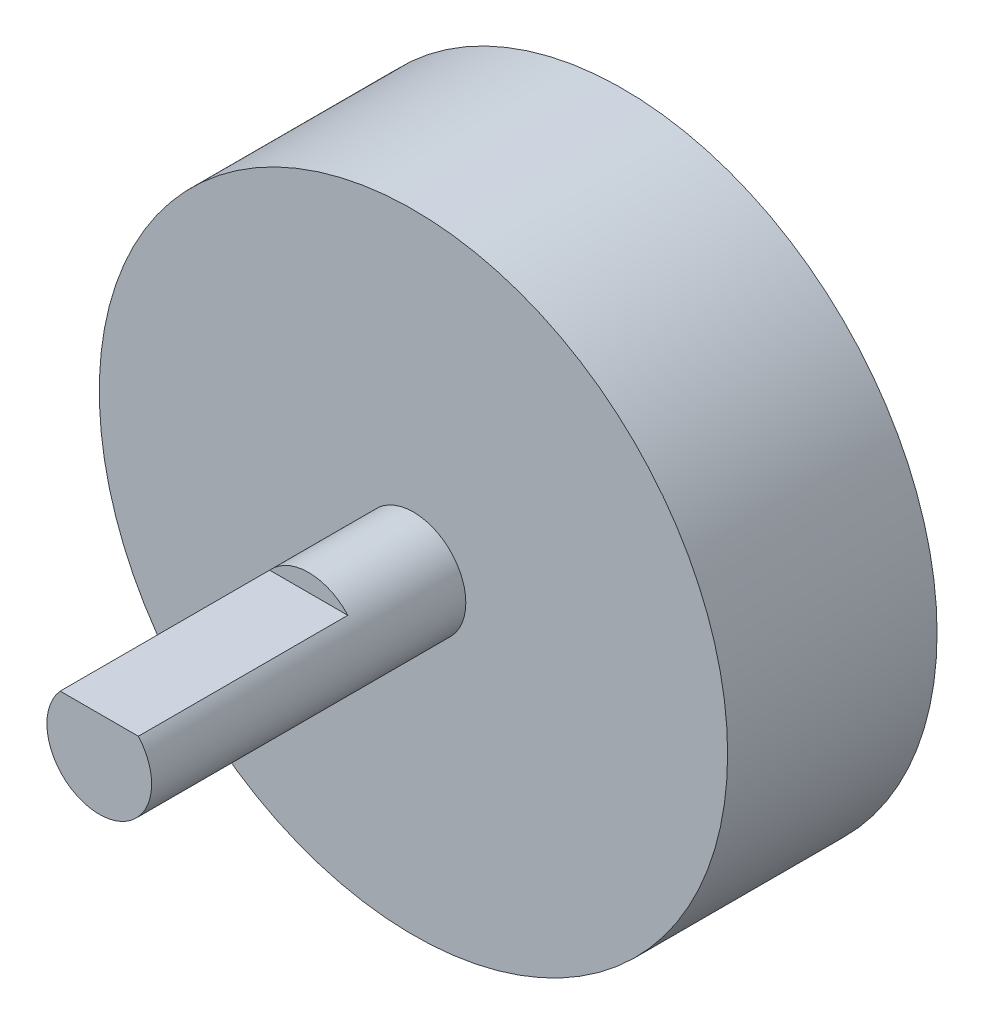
SolidWorks part; units mm, degrees
ref_plane "Front Plane" through (0, 0, 0) normal (0, 0, 1) x (1, 0, 0)
ref_plane "Top Plane" through (0, 0, 0) normal (0, 1, 0) x (1, 0, 0)
ref_plane "Right Plane" through (0, 0, 0) normal (1, 0, 0) x (0, 0, -1)
sketch "Sketch1" plane through (0, 0, 0) normal (0, 0, 1) x (1, 0, 0)
  circle A0 centre (0, 0) radius 19.05
extrude "Boss-Extrude1" add sketch "Sketch1" along normal blind 12.7
sketch "Sketch2" plane through (0, 0, 12.7) normal (0, 0, 1) x (1, 0, 0)
  circle A0 centre (0, 0) radius 3.175
extrude "Boss-Extrude2" add sketch "Sketch2" along normal blind 19.05
sketch "Sketch3" plane through (0, 0, 31.75) normal (0, 0, 1) x (1, 0, 0)
  line L1 (-3.6318, 3.5591) -> (3.9436, 3.5591)
  line L2 (-3.6318, 3.5591) -> (-3.6318, 2.1124)
  line L3 (-3.6318, 2.1124) -> (3.9436, 2.1124)
  line L4 (3.9436, 3.5591) -> (3.9436, 2.1124)
extrude "Cut-Extrude1" cut sketch "Sketch3" against normal blind 12.7
